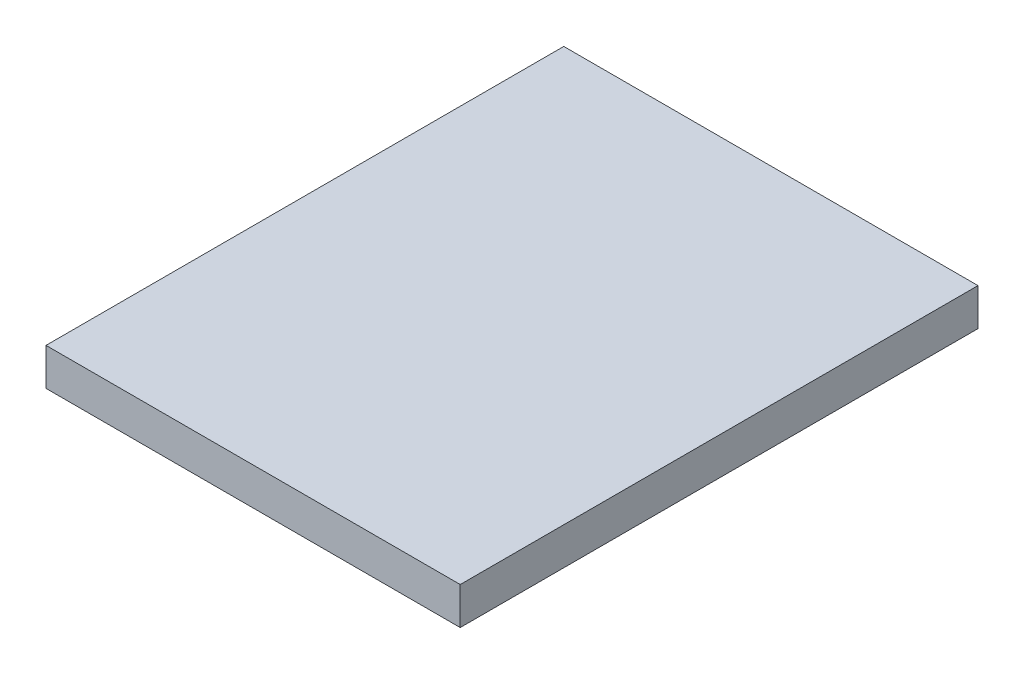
SolidWorks part; units mm, degrees
ref_plane "Front Plane" through (0, 0, 0) normal (0, 0, 1) x (1, 0, 0)
ref_plane "Top Plane" through (0, 0, 0) normal (0, 1, 0) x (1, 0, 0)
ref_plane "Right Plane" through (0, 0, 0) normal (1, 0, 0) x (0, 0, -1)
sketch "Sketch1" plane through (0, 0, 0) normal (0, 1, 0) x (1, 0, 0)
  line L1 (-100, -125) -> (100, -125)
  line L2 (-100, -125) -> (-100, 125)
  line L3 (-100, 125) -> (100, 125)
  line L4 (100, -125) -> (100, 125)
  line L5 (-100, -125) -> (100, 125) construction
  line L6 (-100, 125) -> (100, -125) construction
  point P0 (0, 0)
  dimension "D1" = 200
  dimension "D2" = 250
extrude "Boss-Extrude1" add sketch "Sketch1" along normal blind 18
sketch "Sketch6" plane through (0, 0, 0) normal (0, -1, 0) x (-1, 0, 0)
  point P0 (-4.6587, -67.6133)
  point P3 (17.3867, -89.6587)
  point P6 (-12.7279, -97.7279)
hole_wizard "Hole1" positions "Sketch6" profile "Sketch5" legacy
sketch "Sketch5" plane through (4.6587, 0, 67.6133) normal (1, 0, 0) x (0, 0, -1)
  line L0 (0, 0) -> (0, 10)
  line L1 (0, 10) -> (1, 10)
  line L2 (1, 10) -> (1, 4)
  line L3 (1, 4) -> (5, 4)
  line L4 (5, 4) -> (5, 0)
  line L5 (5, 0) -> (0, 0)
  line L6 (0, 110) -> (0, -10) construction
  dimension "Diameter" = 2
  dimension "Depth" = 10
  dimension "C-Bore Diameter" = 10
  dimension "C-Bore Depth" = 4
sketch "Sketch7" plane through (0, 0, 0) normal (0, -1, 0) x (-1, 0, 0)
  point P0 (97.035, -70.5545)
  point P3 (54.965, -70.5545)
  point P6 (54.965, -118.5945)
  point P9 (97.035, -118.5945)
hole_wizard "Hole2" positions "Sketch7" profile "Sketch8" legacy
sketch "Sketch8" plane through (-97.035, 0, 70.5545) normal (1, 0, 0) x (0, 0, -1)
  line L0 (0, 0) -> (0, 18)
  line L1 (0, 18) -> (1.5, 18)
  line L2 (1.5, 18) -> (1.5, 4)
  line L3 (1.5, 4) -> (2.5, 4)
  line L4 (2.5, 4) -> (2.5, 0)
  line L5 (2.5, 0) -> (0, 0)
  line L6 (0, 110) -> (0, -10) construction
  dimension "Diameter" = 3
  dimension "Depth" = 18
  dimension "C-Bore Diameter" = 5
  dimension "C-Bore Depth" = 4
